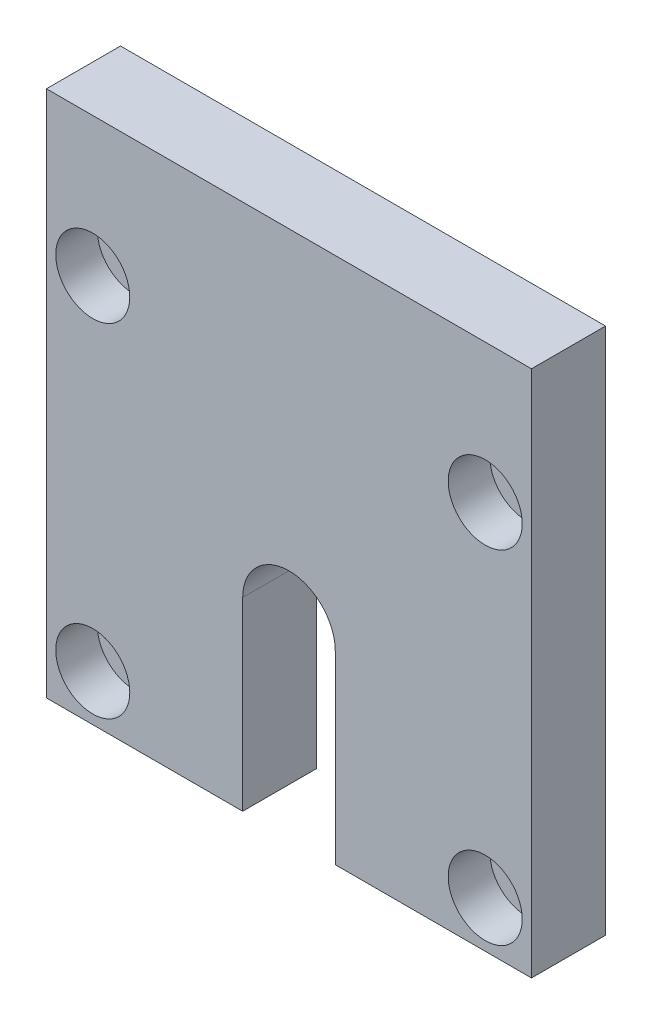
SolidWorks part; units mm, degrees
ref_plane "前视基准面" through (0, 0, 0) normal (0, 0, 1) x (1, 0, 0)
ref_plane "上视基准面" through (0, 0, 0) normal (0, 1, 0) x (1, 0, 0)
ref_plane "右视基准面" through (0, 0, 0) normal (1, 0, 0) x (0, 0, -1)
sketch "草图1" plane through (0, 0, 0) normal (0, 0, 1) x (1, 0, 0)
  line L0 (0, 0) -> (0, 57)
  line L1 (52.4, 0) -> (52.4, 57)
  line L2 (0, 0) -> (21.2, 0)
  line L3 (0, 57) -> (52.4, 57)
  line L4 (21.2, 0) -> (21.2, 20)
  line L5 (31.2, 0) -> (31.2, 20)
  line L6 (31.2, 0) -> (52.4, 0)
  circle A0 centre (5, 42) radius 2.25
  circle A1 centre (47.4, 42) radius 2.25
  circle A2 centre (47.4, 5) radius 2.25
  circle A3 centre (5, 5) radius 2.25
  arc A4 (31.2, 20) -> (21.2, 20) centre (26.2, 20) ccw
extrude "凸台-拉伸1" add sketch "草图1" along normal blind 8
sketch "草图2" plane through (0, 0, 8) normal (0, 0, 1) x (1, 0, 0)
  circle A0 centre (5, 42) radius 4
  circle A1 centre (47.4, 42) radius 4
  circle A2 centre (47.4, 5) radius 4
  circle A3 centre (5, 5) radius 4
extrude "切除-拉伸1" cut sketch "草图2" against normal blind 4.5
